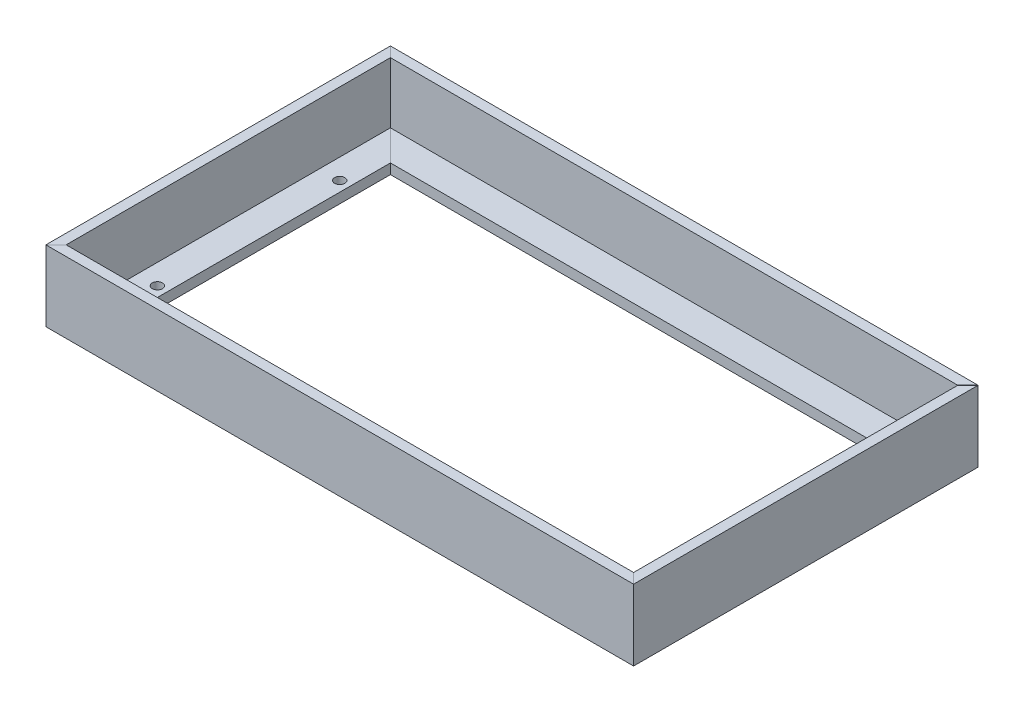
SolidWorks part; units mm, degrees
ref_plane "Front Plane" through (0, 0, 0) normal (0, 0, 1) x (1, 0, 0)
ref_plane "Top Plane" through (0, 0, 0) normal (0, 1, 0) x (1, 0, 0)
ref_plane "Right Plane" through (0, 0, 0) normal (1, 0, 0) x (0, 0, -1)
sketch "Sketch1" plane through (0, 0, 0) normal (0, 0, 1) x (1, 0, 0)
  line L0 (0, 0) -> (0, 22.225)
  line L1 (0, 0) -> (12.7, 0)
  line L2 (12.7, 0) -> (12.7, 3.175)
  line L3 (12.7, 3.175) -> (3.175, 3.175)
  line L4 (3.175, 3.175) -> (3.175, 22.225)
  line L5 (3.175, 22.225) -> (0, 22.225)
  line L6 (92.075, 86.6603) -> (92.075, -76.0664) construction
  line L7 (180.975, 22.225) -> (184.15, 22.225)
  line L8 (180.975, 3.175) -> (180.975, 22.225)
  line L9 (171.45, 3.175) -> (180.975, 3.175)
  line L10 (171.45, 0) -> (171.45, 3.175)
  line L11 (184.15, 0) -> (171.45, 0)
  line L12 (184.15, 0) -> (184.15, 22.225)
  dimension "D1" = 3.175
  dimension "D2" = 3.175
  dimension "D3" = 22.225
  dimension "D4" = 12.7
  dimension "D5" = 88.9
extrude "Boss-Extrude1" add sketch "Sketch1" along normal mid plane 107.95
sketch "Sketch2" plane through (0, 0, 53.975) normal (0, 0, 1) x (1, 0, 0)
  line L1 (0, 22.225) -> (184.15, 22.225)
  line L2 (0, 22.225) -> (0, 0)
  line L3 (0, 0) -> (184.15, 0)
  line L4 (184.15, 22.225) -> (184.15, 0)
extrude "Boss-Extrude2" add sketch "Sketch2" against normal blind 3.175
sketch "Sketch3" plane through (0, 0, -53.975) normal (0, 0, -1) x (-1, 0, 0)
  line L1 (-184.15, 22.225) -> (0, 22.225)
  line L2 (-184.15, 22.225) -> (-184.15, 0)
  line L3 (-184.15, 0) -> (0, 0)
  line L4 (0, 22.225) -> (0, 0)
extrude "Boss-Extrude3" add sketch "Sketch3" against normal blind 3.175
sketch "Sketch4" plane through (0, 3.175, 0) normal (0, 1, 0) x (1, 0, 0)
  line L0 (3.175, 50.8) -> (180.975, 50.8) construction
  line L1 (12.7, 50.8) -> (171.45, 50.8)
  line L2 (12.7, 50.8) -> (12.7, 41.275)
  line L3 (12.7, 41.275) -> (171.45, 41.275)
  line L4 (171.45, 50.8) -> (171.45, 41.275)
  line L5 (12.7, -50.8) -> (12.7, 50.8) construction
  line L6 (171.45, -50.8) -> (171.45, 50.8) construction
  line L8 (12.7, -50.8) -> (171.45, -50.8)
  line L9 (12.7, -50.8) -> (12.7, -41.275)
  line L10 (12.7, -41.275) -> (171.45, -41.275)
  line L11 (171.45, -50.8) -> (171.45, -41.275)
  dimension "D1" = 9.525
  dimension "D2" = 9.525
extrude "Boss-Extrude4" add sketch "Sketch4" against normal blind 3.175
sketch "Sketch6" plane through (0, 22.225, 0) normal (0, 1, 0) x (1, 0, 0)
  line L0 (0, 53.975) -> (12.7, 41.275) construction
  line L1 (92.075, 53.975) -> (92.075, -53.975) construction
  line L2 (184.15, 53.975) -> (0, 53.975) construction
  line L3 (184.15, -53.975) -> (0, -53.975) construction
  line L4 (0, 0) -> (184.15, 0) construction
  line L5 (184.15, 53.975) -> (184.15, -53.975) construction
  line L6 (-0.018, 53.957) -> (12.682, 41.257)
  line L7 (0.018, 53.993) -> (12.718, 41.293)
  line L8 (12.682, 41.257) -> (12.718, 41.2211)
  line L9 (12.718, 41.293) -> (12.7539, 41.257)
  line L10 (12.7539, 41.257) -> (12.718, 41.2211)
  line L11 (-0.018, 53.957) -> (0.018, 53.993)
  line L12 (184.15, 53.975) -> (171.45, 41.275) construction
  line L13 (184.168, 53.957) -> (184.132, 53.993)
  line L14 (171.3961, 41.257) -> (171.432, 41.2211)
  line L15 (171.432, 41.293) -> (171.3961, 41.257)
  line L16 (171.468, 41.257) -> (171.432, 41.2211)
  line L17 (184.132, 53.993) -> (171.432, 41.293)
  line L18 (184.168, 53.957) -> (171.468, 41.257)
  line L19 (184.15, -53.975) -> (171.45, -41.275) construction
  line L20 (0, -53.975) -> (12.7, -41.275) construction
  line L21 (184.168, -53.957) -> (171.468, -41.257)
  line L22 (184.132, -53.993) -> (171.432, -41.293)
  line L23 (171.468, -41.257) -> (171.432, -41.2211)
  line L24 (171.432, -41.293) -> (171.3961, -41.257)
  line L25 (171.3961, -41.257) -> (171.432, -41.2211)
  line L26 (184.168, -53.957) -> (184.132, -53.993)
  line L27 (-0.018, -53.957) -> (0.018, -53.993)
  line L28 (12.7539, -41.257) -> (12.718, -41.2211)
  line L29 (12.718, -41.293) -> (12.7539, -41.257)
  line L30 (12.682, -41.257) -> (12.718, -41.2211)
  line L31 (0.018, -53.993) -> (12.718, -41.293)
  line L32 (-0.018, -53.957) -> (12.682, -41.257)
  dimension "D1" = 0.0254
  dimension "D2" = 0.0254
extrude "Cut-Extrude1" cut sketch "Sketch6" against normal through all
sketch "Sketch7" plane through (0, 3.175, 0) normal (0, 1, 0) x (1, 0, 0)
  circle A0 centre (174.625, 28.575) radius 1.5875
  circle A1 centre (174.625, -28.575) radius 1.5875
  circle A2 centre (9.525, 28.575) radius 1.5875
  circle A3 centre (9.525, -28.575) radius 1.5875
extrude "Cut-Extrude2" cut sketch "Sketch7" against normal through all
